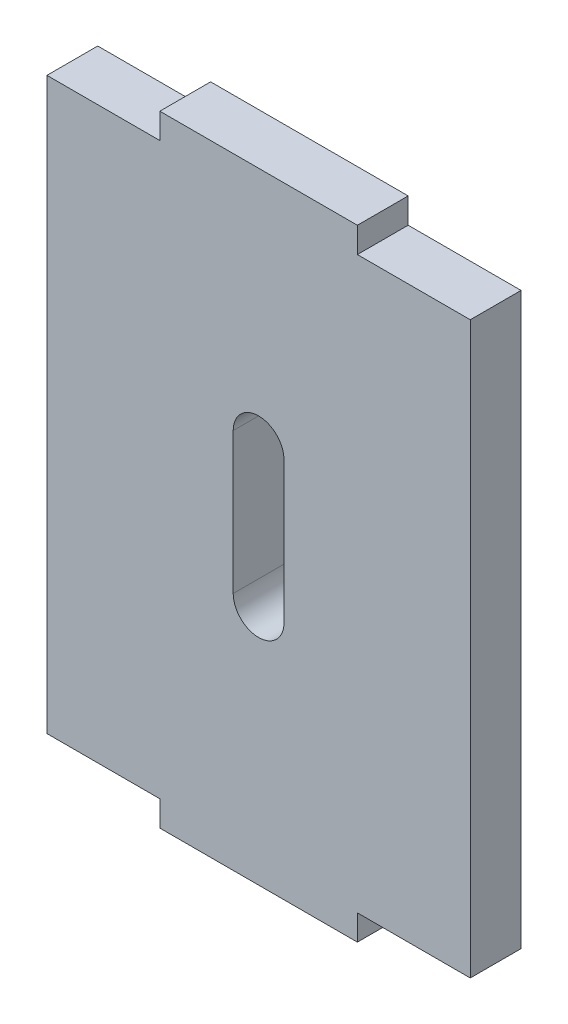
SolidWorks part; units mm, degrees
ref_plane "Front Plane" through (0, 0, 0) normal (0, 0, 1) x (1, 0, 0)
ref_plane "Top Plane" through (0, 0, 0) normal (0, 1, 0) x (1, 0, 0)
ref_plane "Right Plane" through (0, 0, 0) normal (1, 0, 0) x (0, 0, -1)
body saved out of another part "Stock-V1-1"
move or copy body "Body-Move/Copy1" bodies to move or copy 101 copy no rotation origin (27.5, 0, -236.5) rotation axis (0, 1, 0) rotation angle 180
other "Move Face1" parameters "D1"=20
